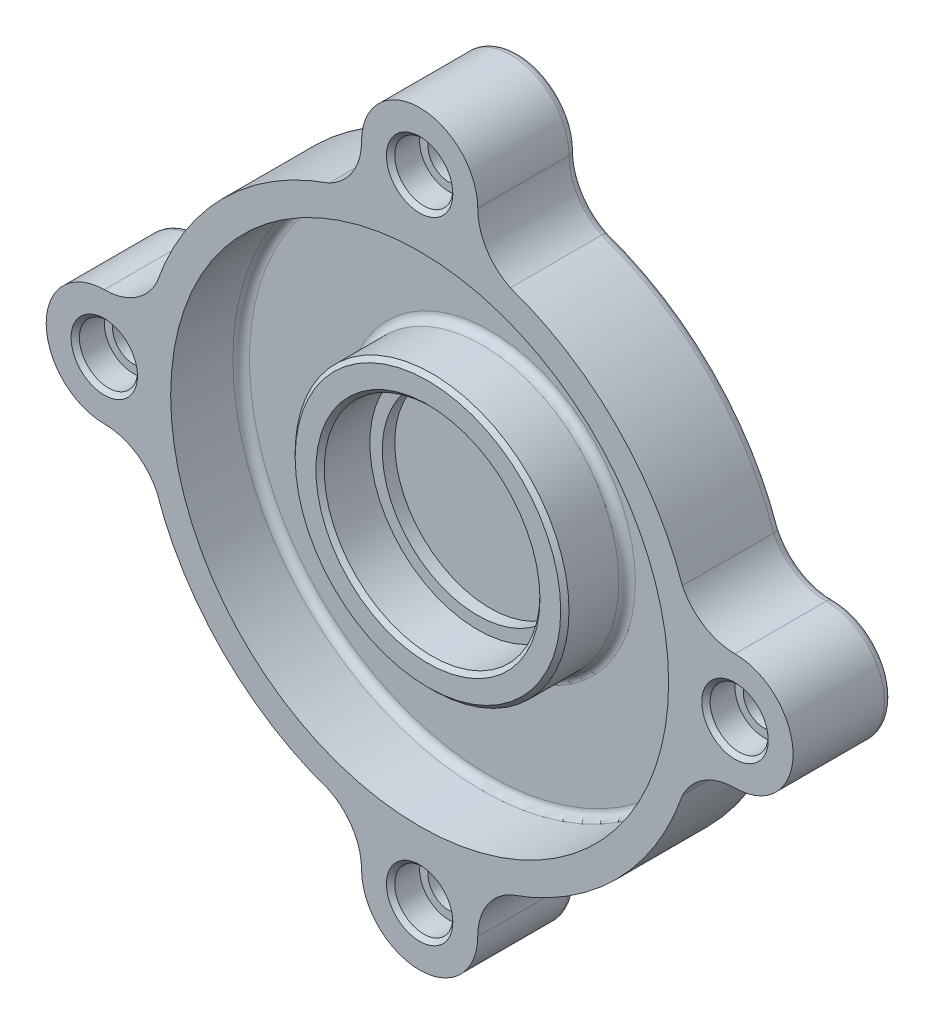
SolidWorks part; units mm, degrees
ref_plane "Přední rovina" through (0, 0, 0) normal (0, 0, 1) x (1, 0, 0)
ref_plane "Horní rovina" through (0, 0, 0) normal (0, 1, 0) x (1, 0, 0)
ref_plane "Pravá rovina" through (0, 0, 0) normal (1, 0, 0) x (0, 0, -1)
sketch "Skica1" plane through (0, 0, 0) normal (0, 0, 1) x (1, 0, 0)
  line L0 (0, 0) -> (67, 0) construction
  line L3 (0, 0) -> (0, 67) construction
  circle A0 centre (0, 0) radius 67
  dimension "D1" = 134
extrude "Přidat vysunutím1" add sketch "Skica1" along normal blind 24
sketch "Skica2" plane through (0, 0, 24) normal (0, 0, 1) x (1, 0, 0)
  line L0 (0, 0) -> (60, 0) construction
  line L2 (0, 60) -> (0, 0) construction
  circle A0 centre (0, 0) radius 60
  dimension "D1" = 120
extrude "Odebrat vysunutím1" cut sketch "Skica2" against normal blind 17
sketch "Skica3" plane through (0, 0, 24) normal (0, 0, 1) x (1, 0, 0)
  line L0 (0, 67) -> (0, 76) construction
  line L1 (0, 0) -> (0, 67) construction
  arc A41 (24.479, 62.3681) -> (-24.479, 62.3681) centre (0, 0) ccw
  arc A42 (13.9998, 75.9182) -> (-13.9998, 75.9182) centre (0, 76) ccw
  arc A43 (24.479, 62.3681) -> (14, 76) centre (27.9998, 75.9182) cw
  arc A44 (-24.479, 62.3681) -> (-14, 76) centre (-27.9998, 75.9182) ccw
  arc A45 (62.3681, -24.479) -> (62.3681, 24.479) centre (0, 0) ccw
  arc A46 (62.3681, 24.479) -> (76, 14) centre (75.9182, 27.9998) ccw
  arc A47 (75.9182, -13.9998) -> (75.9182, 13.9998) centre (76, 0) ccw
  arc A48 (62.3681, -24.479) -> (76, -14) centre (75.9182, -27.9998) cw
  arc A49 (-24.479, -62.3681) -> (24.479, -62.3681) centre (0, 0) ccw
  arc A50 (24.479, -62.3681) -> (14, -76) centre (27.9998, -75.9182) ccw
  arc A51 (-13.9998, -75.9182) -> (13.9998, -75.9182) centre (0, -76) ccw
  arc A52 (-24.479, -62.3681) -> (-14, -76) centre (-27.9998, -75.9182) cw
  arc A53 (-62.3681, 24.479) -> (-62.3681, -24.479) centre (0, 0) ccw
  arc A54 (-62.3681, -24.479) -> (-76, -14) centre (-75.9182, -27.9998) ccw
  arc A55 (-75.9182, 13.9998) -> (-75.9182, -13.9998) centre (-76, 0) ccw
  arc A56 (-62.3681, 24.479) -> (-76, 14) centre (-75.9182, 27.9998) cw
  point P42 (0, 0)
  dimension "D1" = 134
  dimension "D2" = 14
  dimension "D3" = 14
  dimension "D4" = 9
  dimension "D5" = 4
extrude "Přidat vysunutím2" add sketch "Skica3" against normal blind 24
sketch "Skica4" plane through (0, 0, 24) normal (0, 0, 1) x (1, 0, 0)
  line L0 (0, 0) -> (67, 0) construction
  line L1 (0, 0) -> (0, 67) construction
  line L2 (0, 67) -> (0, 76) construction
  circle A5 centre (0, 76) radius 5
  circle A6 centre (76, 0) radius 5
  circle A7 centre (0, -76) radius 5
  circle A8 centre (-76, 0) radius 5
  point P15 (0, 0)
  point P16 (0, 0)
  dimension "D1" = 9
  dimension "D3" = 10
  dimension "D2" = 67
  dimension "D4" = 4
extrude "Odebrat vysunutím2" cut sketch "Skica4" against normal blind 24
sketch "Skica7" plane through (0, 0, 24) normal (0, 0, 1) x (1, 0, 0)
  line L0 (0, 0) -> (0, 76) construction
  circle A0 centre (0, 76) radius 7
  circle A1 centre (0, 76) radius 5
  circle A2 centre (76, 0) radius 7
  circle A3 centre (76, 0) radius 5
  circle A4 centre (0, -76) radius 7
  circle A5 centre (0, -76) radius 5
  circle A6 centre (-76, 0) radius 7
  circle A7 centre (-76, 0) radius 5
  point P18 (0, 0)
  dimension "D1" = 14
  dimension "D2" = 10
  dimension "D3" = 4
extrude "Odebrat vysunutím3" cut sketch "Skica7" against normal blind 7
sketch "Skica8" plane through (0, 0, 0) normal (0, 0, -1) x (-1, 0, 0)
  line L0 (0, 0) -> (0, 76) construction
  circle A0 centre (0, 76) radius 5
  circle A1 centre (0, 76) radius 8
  circle A2 centre (76, 0) radius 8
  circle A3 centre (76, 0) radius 5
  circle A4 centre (0, -76) radius 8
  circle A5 centre (0, -76) radius 5
  circle A6 centre (-76, 0) radius 8
  circle A7 centre (-76, 0) radius 5
  point P18 (0, 0)
  dimension "D1" = 10
  dimension "D2" = 16
  dimension "D3" = 4
extrude "Odebrat vysunutím4" cut sketch "Skica8" against normal blind 7
sketch "Skica5" plane through (0, 0, 7) normal (0, 0, 1) x (1, 0, 0)
  line L0 (0, 0) -> (40, 0) construction
  line L1 (0, 0) -> (0, 40) construction
  circle A0 centre (0, 0) radius 26
  circle A1 centre (0, 0) radius 33
  dimension "D1" = 52
  dimension "D2" = 66
extrude "Přidat vysunutím3" add sketch "Skica5" along normal blind 15
sketch "Skica6" plane through (0, 0, 7) normal (0, 0, 1) x (1, 0, 0)
  circle A0 centre (0, 0) radius 26
  circle A1 centre (0, 0) radius 23
  dimension "D1" = 46
  dimension "D2" = 52
extrude "Přidat vysunutím4" add sketch "Skica6" along normal blind 3
fillet "Zaoblit1" radius 2 18 edges at (60, 0, 7) (33, 0, 7) (-16.1103, 68.5262, 0) (0, 90, 0) (68.5262, 16.1103, 0) (90, 0, 0) (-68.5262, 16.1103, 0) (-47.3762, 47.3762, 0) (16.1103, 68.5262, 0) (47.3762, 47.3762, 0) (68.5262, -16.1103, 0) (16.1103, -68.5262, 0) (0, -90, 0) (-16.1103, -68.5262, 0) (-90, 0, 0) (-68.5262, -16.1103, 0) (-47.3762, -47.3762, 0) (47.3762, -47.3762, 0)
chamfer "Zkosení2" distance 1 angle 45 10 edges at (26, 0, 22) (33, 0, 22) (-8, 76, 0) (-69, 0, 24) (7, -76, 24) (83, 0, 24) (7, 76, 24) (-84, 0, 0) (-8, -76, 0) (68, 0, 0)
chamfer "Zkosení3" distance 1 angle 60 4 edges at (-81, 0, 7) (-5, -76, 7) (-5, 76, 7) (71, 0, 7)
equation "\"17mmmm\"=18"
